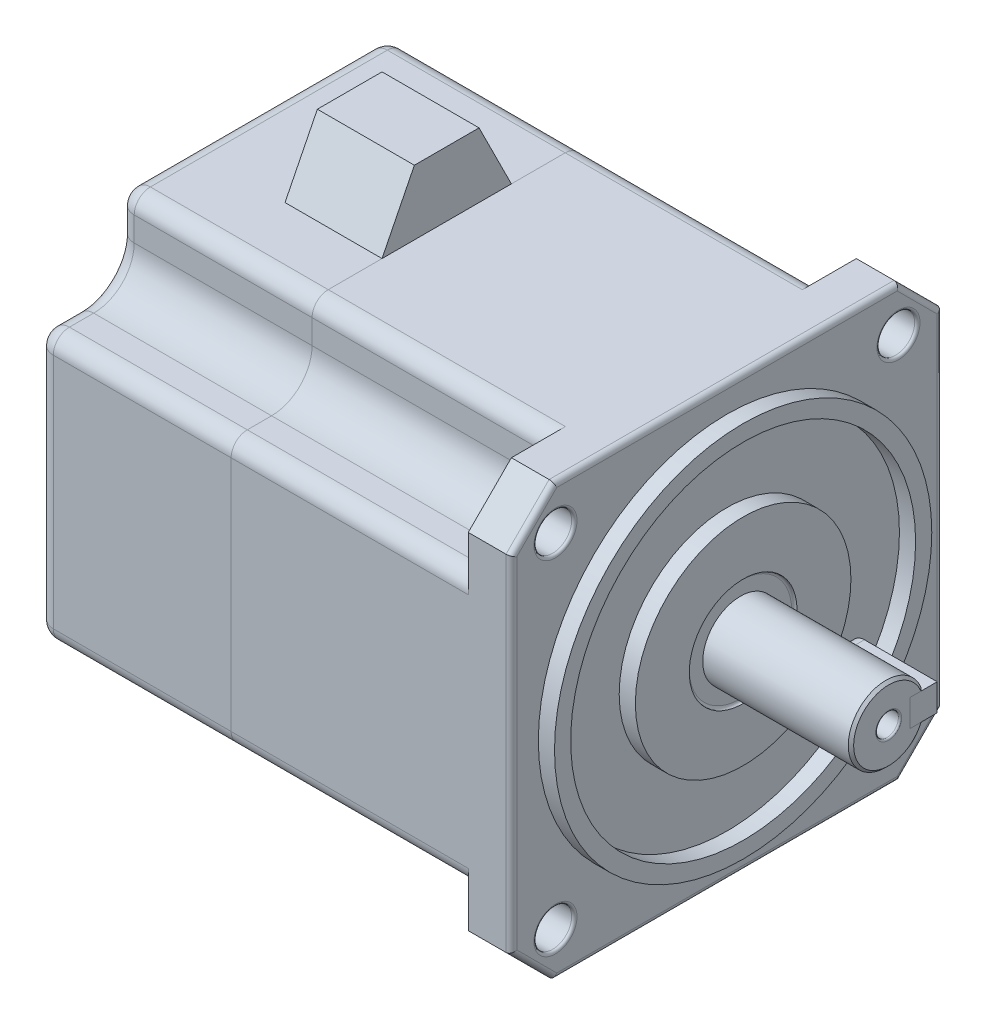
SolidWorks part; units mm, degrees
ref_plane "前视基准面" through (0, 0, 0) normal (0, 0, 1) x (1, 0, 0)
ref_plane "上视基准面" through (0, 0, 0) normal (0, 1, 0) x (1, 0, 0)
ref_plane "右视基准面" through (0, 0, 0) normal (1, 0, 0) x (0, 0, -1)
sketch "草图1" plane through (0, 0, 0) normal (1, 0, 0) x (0, 0, -1)
  line L0 (-40, 32) -> (-32, 40)
  line L1 (-32, -40) -> (32, -40)
  line L2 (-40, -32) -> (-40, 32)
  line L3 (-32, 40) -> (32, 40)
  line L4 (40, -32) -> (40, 32)
  line L5 (-40, -40) -> (40, 40) construction
  line L6 (-40, 40) -> (40, -40) construction
  line L7 (32, 40) -> (40, 32)
  line L8 (32, -40) -> (40, -32)
  line L9 (-40, -32) -> (-32, -40)
  point P0 (0, 0)
extrude "凸台-拉伸1" add sketch "草图1" against normal blind 52
sketch "草图2" plane through (-52, 0, 0) normal (-1, 0, 0) x (0, 0, 1)
  line L0 (-32, 40) -> (32, 40) construction
  line L1 (-32, -40) -> (32, -40)
  line L2 (-40, -32) -> (-40, 32)
  line L3 (-32, 40) -> (32, 40)
  line L4 (40, -32) -> (40, 32)
  line L5 (-40, -40) -> (40, 40) construction
  line L6 (-40, 40) -> (40, -40) construction
  line L7 (-40, 32) -> (-32, 40)
  line L8 (-32, -40) -> (-40, -32)
  line L9 (32, -40) -> (40, -32)
  line L10 (40, 32) -> (32, 40)
  point P0 (0, 0)
extrude "凸台-拉伸2" add sketch "草图2" along normal blind 36 separate body
sketch "草图3" plane through (-88, 0, 0) normal (-1, 0, 0) x (0, 0, 1)
  line L0 (-32.5, 24.9834) -> (-37, 24.9834)
  line L1 (-40, 32) -> (-40, -32) construction
  line L3 (-37, -24.9834) -> (-32.5, -24.9834)
  line L4 (-40, 21.9834) -> (-40, 32)
  line L5 (-24.9834, -32.5) -> (-24.9834, -37)
  line L6 (-32, -40) -> (32, -40) construction
  line L8 (24.9834, -37) -> (24.9834, -32.5)
  line L9 (-40, 32) -> (-32, 40)
  line L10 (32.5, -24.9834) -> (37, -24.9834)
  line L11 (40, -32) -> (40, 32) construction
  line L13 (37, 24.9834) -> (32.5, 24.9834)
  line L14 (-32, 40) -> (-21.9834, 40)
  line L15 (24.9834, 32.5) -> (24.9834, 37)
  line L16 (32, 40) -> (-32, 40) construction
  line L18 (-24.9834, 37) -> (-24.9834, 32.5)
  line L19 (21.9834, 40) -> (32, 40)
  line L20 (32, 40) -> (40, 32)
  line L21 (40, 32) -> (40, 21.9834)
  line L22 (40, -21.9834) -> (40, -32)
  line L23 (40, -32) -> (32, -40)
  line L24 (32, -40) -> (40, -32) construction
  line L25 (32, -40) -> (21.9834, -40)
  line L26 (-21.9834, -40) -> (-32, -40)
  line L27 (-32, -40) -> (-40, -32)
  line L28 (-40, -32) -> (-40, -21.9834)
  arc A0 (-32.5, 24.9834) -> (-24.9834, 32.5) centre (-32.5, 32.5) ccw
  arc A1 (24.9834, 32.5) -> (32.5, 24.9834) centre (32.5, 32.5) ccw
  arc A2 (32.5, -24.9834) -> (24.9834, -32.5) centre (32.5, -32.5) ccw
  arc A3 (-24.9834, -32.5) -> (-32.5, -24.9834) centre (-32.5, -32.5) ccw
  arc A4 (-40, 21.9834) -> (-37, 24.9834) centre (-37, 21.9834) cw
  arc A5 (-21.9834, 40) -> (-24.9834, 37) centre (-21.9834, 37) ccw
  arc A6 (21.9834, 40) -> (24.9834, 37) centre (21.9834, 37) cw
  arc A7 (37, 24.9834) -> (40, 21.9834) centre (37, 21.9834) cw
  arc A8 (40, -21.9834) -> (37, -24.9834) centre (37, -21.9834) cw
  arc A9 (24.9834, -37) -> (21.9834, -40) centre (21.9834, -37) cw
  arc A10 (-21.9834, -40) -> (-24.9834, -37) centre (-21.9834, -37) cw
  arc A11 (-37, -24.9834) -> (-40, -21.9834) centre (-37, -21.9834) cw
  point P0 (0, 0)
  point P10 (-40, 24.9834)
  point P38 (-24.9834, 40)
  point P41 (24.9834, 40)
  point P44 (40, 24.9834)
  point P47 (40, -24.9834)
  point P50 (24.9834, -40)
  point P53 (-24.9834, -40)
  point P56 (-40, -24.9834)
  dimension "D1" = 3
extrude "切除-拉伸1" cut sketch "草图3" against normal blind 80
sketch "草图4" plane through (0, 0, 0) normal (1, 0, 0) x (0, 0, -1)
  circle A1 centre (-31.8198, -31.8198) radius 3.5
  circle A2 centre (31.8198, -31.8198) radius 3.5
  circle A3 centre (31.8198, 31.8198) radius 3.5
  circle A4 centre (-31.8198, 31.8198) radius 3.5
extrude "切除-拉伸2" cut sketch "草图4" against normal blind 8
fillet "圆角1" radius 3 24 edges at (-88, 24.9834, -34.75) (-88, 27.1849, -27.1849) (-88, 34.75, -24.9834) (-88, 39.1213, -24.1047) (-88, 40, 0) (-88, 39.1213, 24.1047) (-88, 34.75, 24.9834) (-88, 27.1849, 27.1849) (-88, 24.9834, 34.75) (-88, 24.1047, 39.1213) (-88, 0, 40) (-88, -24.1047, 39.1213) (-88, -24.9834, 34.75) (-88, -27.1849, 27.1849) (-88, -34.75, 24.9834) (-88, -39.1213, 24.1047) (-88, -40, 0) (-88, -39.1213, -24.1047) (-88, -34.75, -24.9834) (-88, -27.1849, -27.1849) (-88, -24.9834, -34.75) (-88, -24.1047, -39.1213) (-88, 0, -40) (-88, 24.1047, -39.1213)
fillet "圆角2" radius 1 8 edges at (0, 36, -36) (0, 0, -40) (0, -36, -36) (0, -40, 0) (0, -36, 36) (0, 0, 40) (0, 36, 36) (0, 40, 0)
sketch "草图5" plane through (0, 0, 0) normal (1, 0, 0) x (0, 0, -1)
  circle A0 centre (0, 0) radius 35
  circle A1 centre (0, 0) radius 32
extrude "凸台-拉伸3" add sketch "草图5" along normal blind 3 separate body
sketch "草图6" plane through (0, 0, 0) normal (1, 0, 0) x (0, 0, -1)
  circle A0 centre (0, 0) radius 20
extrude "凸台-拉伸4" add sketch "草图6" along normal blind 3
sketch "草图7" plane through (3, 0, 0) normal (1, 0, 0) x (0, 0, -1)
  circle A0 centre (0, 0) radius 10
extrude "切除-拉伸3" cut sketch "草图7" against normal blind 0.5
fillet "圆角3" radius 0.5 1 edges at (2.5, 0, -10)
sketch "草图8" plane through (2.5, 0, 0) normal (1, 0, 0) x (0, 0, -1)
  circle A0 centre (0, 0) radius 7
extrude "凸台-拉伸5" add sketch "草图8" along normal blind 27.5
ref_plane "基准面1" through (0, 0, -7) normal (0, 0, 1) x (1, 0, 0)
sketch "草图9" plane through (0, 0, -7) normal (0, 0, 1) x (1, 0, 0)
  line L1 (30, -7) -> (30, 7) construction
  line L2 (16.5, 2.5) -> (30, 2.5)
  line L3 (30, 2.5) -> (30, -2.5)
  line L4 (30, -2.5) -> (16.5, -2.5)
  arc A0 (16.5, 2.5) -> (16.5, -2.5) centre (16.5, 0) ccw
extrude "切除-拉伸5" cut sketch "草图9" along normal blind 3
sketch "草图10" plane through (0, 0, -4) normal (0, 0, -1) x (-1, 0, 0)
  line L0 (-16.5, 2.5) -> (-30, 2.5)
  line L1 (-30, 2.5) -> (-30, -2.5)
  line L2 (-30, -2.5) -> (-16.5, -2.5)
  arc A0 (-16.5, -2.5) -> (-16.5, 2.5) centre (-16.5, 0) ccw
extrude "凸台-拉伸6" add sketch "草图10" along normal blind 5 separate body
chamfer "倒角1" distance 0.5 angle 45 1 edges at (30, 0, 7)
sketch "草图12" plane through (0, 40, 0) normal (0, 1, 0) x (1, 0, 0)
  line L3 (-70, -12) -> (-52, -12)
  line L4 (-70, -12) -> (-70, 12)
  line L5 (-70, 12) -> (-52, 12)
  line L6 (-52, -12) -> (-52, 12)
  line L7 (-70, -12) -> (-52, 12) construction
  line L8 (-70, 12) -> (-52, -12) construction
extrude "凸台-拉伸7" add sketch "草图12" along normal blind 12 separate body
sketch "草图13" plane through (-52, 0, 0) normal (1, 0, 0) x (0, 0, -1)
  line L0 (-12, 40) -> (-12, 52)
  line L1 (-12, 52) -> (-6, 52)
  line L2 (-12, 52) -> (12, 52) construction
  line L3 (12, 40) -> (12, 52)
  line L4 (12, 52) -> (6, 52)
  line L5 (-6, 52) -> (-12, 40)
  line L6 (6, 52) -> (12, 40)
extrude "切除-拉伸6" cut sketch "草图13" against normal blind 18
hole_wizard "M5 螺纹孔1" positions "草图15" profile "草图14" tap size "M5" standard "GB"
sketch "草图15" plane through (30, 0, 0) normal (1, 0, 0) x (0, 0, -1)
  point P0 (0, 0)
sketch "草图14" plane through (30, 0, 0) normal (0, 1, 0) x (0, 0, -1)
  line L0 (0, 0) -> (0, 9.2618)
  line L1 (0, 9.2618) -> (2.1, 8)
  line L2 (2.1, 8) -> (2.1, 0)
  line L5 (2.1, 0) -> (0, 0)
  line L10 (0, 9.2618) -> (-2.1, 8) construction
  line L11 (0, -6.35) -> (0, 107.95) construction
  dimension "螺纹孔钻头直径" = 4.2
  dimension "螺纹孔钻头深度" = 8
  dimension "导头角度" = 118
fillet "圆角4" radius 0.3 1 edges at (22, 0, -2.1)
fillet "圆角5" radius 0.5 4 edges at (0, -31.8198, 28.3198) (0, -31.8198, -35.3198) (0, 31.8198, -35.3198) (0, 31.8198, 28.3198)
fillet "圆角6" radius 0.3 1 edges at (30, 0, -2.1)
